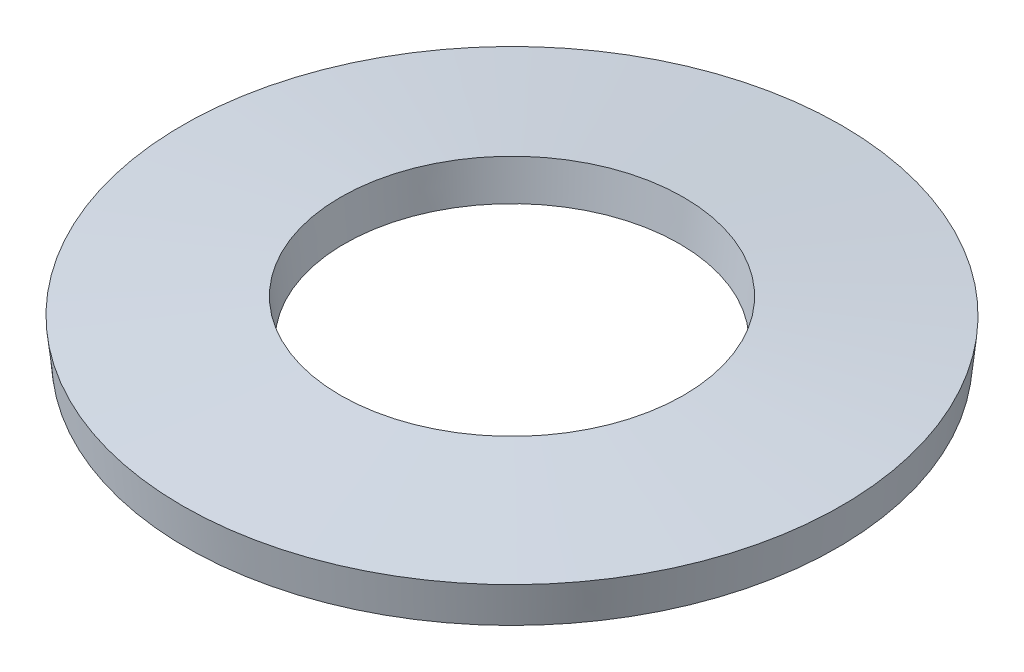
SolidWorks part; units mm, degrees
ref_plane "Plan de face" through (0, 0, 0) normal (0, 0, 1) x (1, 0, 0)
ref_plane "Plan de dessus" through (0, 0, 0) normal (0, 1, 0) x (1, 0, 0)
ref_plane "Plan de droite" through (0, 0, 0) normal (1, 0, 0) x (0, 0, -1)
sketch "Esquisse1" plane through (0, 0, 0) normal (0, 0, 1) x (1, 0, 0)
  line L0 (15.6177, 5) -> (15.25, 1.5194)
  line L1 (15.25, 1.5194) -> (29.6323, 0)
  line L2 (29.6323, 0) -> (30, 3.4806)
  line L3 (30, 3.4806) -> (15.6177, 5)
  line L4 (0, 0) -> (0, 54.9683) construction
  dimension "D1" = 3.5
  dimension "D2" = 15.25
  dimension "D3" = 5
  dimension "D4" = 30
revolve "Révolution1" add sketch "Esquisse1" angle 360 about L4
